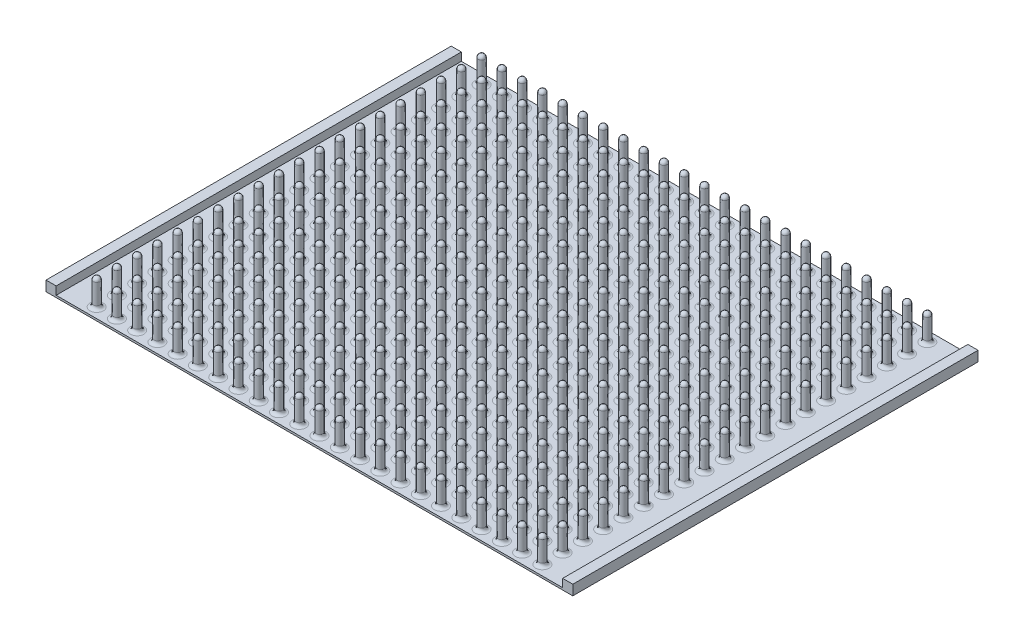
SolidWorks part; units mm, degrees
ref_plane "Front Plane" through (0, 0, 0) normal (0, 0, 1) x (1, 0, 0)
ref_plane "Top Plane" through (0, 0, 0) normal (0, 1, 0) x (1, 0, 0)
ref_plane "Right Plane" through (0, 0, 0) normal (1, 0, 0) x (0, 0, -1)
sketch "Sketch1" plane through (0, 0, 0) normal (0, 1, 0) x (1, 0, 0)
  line L1 (-75, 60) -> (75, 60)
  line L2 (-75, 60) -> (-75, -60)
  line L3 (-75, -60) -> (75, -60)
  line L4 (75, 60) -> (75, -60)
  line L5 (-75, 60) -> (75, -60) construction
  line L6 (-75, -60) -> (75, 60) construction
  point P0 (0, 0)
  dimension "D1" = 150
  dimension "D2" = 120
extrude "Boss-Extrude1" add sketch "Sketch1" along normal blind 0.2
sketch "Sketch2" plane through (0, 0.2, 0) normal (0, 1, 0) x (1, 0, 0)
  line L2 (-75, 60) -> (-75, -60) construction
  line L4 (75, 60) -> (-75, 60) construction
  circle A595 centre (-72, 57) radius 1
  circle A596 centre (-66, 57) radius 1
  circle A597 centre (-60, 57) radius 1
  circle A598 centre (-54, 57) radius 1
  circle A599 centre (-48, 57) radius 1
  circle A600 centre (-42, 57) radius 1
  circle A601 centre (-36, 57) radius 1
  circle A602 centre (-30, 57) radius 1
  circle A603 centre (-24, 57) radius 1
  circle A604 centre (-18, 57) radius 1
  circle A605 centre (-12, 57) radius 1
  circle A606 centre (-6, 57) radius 1
  circle A607 centre (0, 57) radius 1
  circle A608 centre (6, 57) radius 1
  circle A609 centre (12, 57) radius 1
  circle A610 centre (18, 57) radius 1
  circle A611 centre (24, 57) radius 1
  circle A612 centre (30, 57) radius 1
  circle A613 centre (36, 57) radius 1
  circle A614 centre (42, 57) radius 1
  circle A615 centre (48, 57) radius 1
  circle A616 centre (54, 57) radius 1
  circle A617 centre (60, 57) radius 1
  circle A618 centre (66, 57) radius 1
  circle A619 centre (72, 57) radius 1
  circle A620 centre (-66, 51) radius 1
  circle A621 centre (-60, 51) radius 1
  circle A622 centre (-54, 51) radius 1
  circle A623 centre (-48, 51) radius 1
  circle A624 centre (-42, 51) radius 1
  circle A625 centre (-36, 51) radius 1
  circle A626 centre (-30, 51) radius 1
  circle A627 centre (-24, 51) radius 1
  circle A628 centre (-18, 51) radius 1
  circle A629 centre (-12, 51) radius 1
  circle A630 centre (-6, 51) radius 1
  circle A631 centre (0, 51) radius 1
  circle A632 centre (6, 51) radius 1
  circle A633 centre (12, 51) radius 1
  circle A634 centre (18, 51) radius 1
  circle A635 centre (24, 51) radius 1
  circle A636 centre (30, 51) radius 1
  circle A637 centre (36, 51) radius 1
  circle A638 centre (42, 51) radius 1
  circle A639 centre (48, 51) radius 1
  circle A640 centre (54, 51) radius 1
  circle A641 centre (60, 51) radius 1
  circle A642 centre (66, 51) radius 1
  circle A643 centre (72, 51) radius 1
  circle A644 centre (-66, 45) radius 1
  circle A645 centre (-60, 45) radius 1
  circle A646 centre (-54, 45) radius 1
  circle A647 centre (-48, 45) radius 1
  circle A648 centre (-42, 45) radius 1
  circle A649 centre (-36, 45) radius 1
  circle A650 centre (-30, 45) radius 1
  circle A651 centre (-24, 45) radius 1
  circle A652 centre (-18, 45) radius 1
  circle A653 centre (-12, 45) radius 1
  circle A654 centre (-6, 45) radius 1
  circle A655 centre (0, 45) radius 1
  circle A656 centre (6, 45) radius 1
  circle A657 centre (12, 45) radius 1
  circle A658 centre (18, 45) radius 1
  circle A659 centre (24, 45) radius 1
  circle A660 centre (30, 45) radius 1
  circle A661 centre (36, 45) radius 1
  circle A662 centre (42, 45) radius 1
  circle A663 centre (48, 45) radius 1
  circle A664 centre (54, 45) radius 1
  circle A665 centre (60, 45) radius 1
  circle A666 centre (66, 45) radius 1
  circle A667 centre (72, 45) radius 1
  circle A668 centre (-66, 39) radius 1
  circle A669 centre (-60, 39) radius 1
  circle A670 centre (-54, 39) radius 1
  circle A671 centre (-48, 39) radius 1
  circle A672 centre (-42, 39) radius 1
  circle A673 centre (-36, 39) radius 1
  circle A674 centre (-30, 39) radius 1
  circle A675 centre (-24, 39) radius 1
  circle A676 centre (-18, 39) radius 1
  circle A677 centre (-12, 39) radius 1
  circle A678 centre (-6, 39) radius 1
  circle A679 centre (0, 39) radius 1
  circle A680 centre (6, 39) radius 1
  circle A681 centre (12, 39) radius 1
  circle A682 centre (18, 39) radius 1
  circle A683 centre (24, 39) radius 1
  circle A684 centre (30, 39) radius 1
  circle A685 centre (36, 39) radius 1
  circle A686 centre (42, 39) radius 1
  circle A687 centre (48, 39) radius 1
  circle A688 centre (54, 39) radius 1
  circle A689 centre (60, 39) radius 1
  circle A690 centre (66, 39) radius 1
  circle A691 centre (72, 39) radius 1
  circle A692 centre (-66, 33) radius 1
  circle A693 centre (-60, 33) radius 1
  circle A694 centre (-54, 33) radius 1
  circle A695 centre (-48, 33) radius 1
  circle A696 centre (-42, 33) radius 1
  circle A697 centre (-36, 33) radius 1
  circle A698 centre (-30, 33) radius 1
  circle A699 centre (-24, 33) radius 1
  circle A700 centre (-18, 33) radius 1
  circle A701 centre (-12, 33) radius 1
  circle A702 centre (-6, 33) radius 1
  circle A703 centre (0, 33) radius 1
  circle A704 centre (6, 33) radius 1
  circle A705 centre (12, 33) radius 1
  circle A706 centre (18, 33) radius 1
  circle A707 centre (24, 33) radius 1
  circle A708 centre (30, 33) radius 1
  circle A709 centre (36, 33) radius 1
  circle A710 centre (42, 33) radius 1
  circle A711 centre (48, 33) radius 1
  circle A712 centre (54, 33) radius 1
  circle A713 centre (60, 33) radius 1
  circle A714 centre (66, 33) radius 1
  circle A715 centre (72, 33) radius 1
  circle A716 centre (-66, 27) radius 1
  circle A717 centre (-60, 27) radius 1
  circle A718 centre (-54, 27) radius 1
  circle A719 centre (-48, 27) radius 1
  circle A720 centre (-42, 27) radius 1
  circle A721 centre (-36, 27) radius 1
  circle A722 centre (-30, 27) radius 1
  circle A723 centre (-24, 27) radius 1
  circle A724 centre (-18, 27) radius 1
  circle A725 centre (-12, 27) radius 1
  circle A726 centre (-6, 27) radius 1
  circle A727 centre (0, 27) radius 1
  circle A728 centre (6, 27) radius 1
  circle A729 centre (12, 27) radius 1
  circle A730 centre (18, 27) radius 1
  circle A731 centre (24, 27) radius 1
  circle A732 centre (30, 27) radius 1
  circle A733 centre (36, 27) radius 1
  circle A734 centre (42, 27) radius 1
  circle A735 centre (48, 27) radius 1
  circle A736 centre (54, 27) radius 1
  circle A737 centre (60, 27) radius 1
  circle A738 centre (66, 27) radius 1
  circle A739 centre (72, 27) radius 1
  circle A740 centre (-66, 21) radius 1
  circle A741 centre (-60, 21) radius 1
  circle A742 centre (-54, 21) radius 1
  circle A743 centre (-48, 21) radius 1
  circle A744 centre (-42, 21) radius 1
  circle A745 centre (-36, 21) radius 1
  circle A746 centre (-30, 21) radius 1
  circle A747 centre (-24, 21) radius 1
  circle A748 centre (-18, 21) radius 1
  circle A749 centre (-12, 21) radius 1
  circle A750 centre (-6, 21) radius 1
  circle A751 centre (0, 21) radius 1
  circle A752 centre (6, 21) radius 1
  circle A753 centre (12, 21) radius 1
  circle A754 centre (18, 21) radius 1
  circle A755 centre (24, 21) radius 1
  circle A756 centre (30, 21) radius 1
  circle A757 centre (36, 21) radius 1
  circle A758 centre (42, 21) radius 1
  circle A759 centre (48, 21) radius 1
  circle A760 centre (54, 21) radius 1
  circle A761 centre (60, 21) radius 1
  circle A762 centre (66, 21) radius 1
  circle A763 centre (72, 21) radius 1
  circle A764 centre (-66, 15) radius 1
  circle A765 centre (-60, 15) radius 1
  circle A766 centre (-54, 15) radius 1
  circle A767 centre (-48, 15) radius 1
  circle A768 centre (-42, 15) radius 1
  circle A769 centre (-36, 15) radius 1
  circle A770 centre (-30, 15) radius 1
  circle A771 centre (-24, 15) radius 1
  circle A772 centre (-18, 15) radius 1
  circle A773 centre (-12, 15) radius 1
  circle A774 centre (-6, 15) radius 1
  circle A775 centre (0, 15) radius 1
  circle A776 centre (6, 15) radius 1
  circle A777 centre (12, 15) radius 1
  circle A778 centre (18, 15) radius 1
  circle A779 centre (24, 15) radius 1
  circle A780 centre (30, 15) radius 1
  circle A781 centre (36, 15) radius 1
  circle A782 centre (42, 15) radius 1
  circle A783 centre (48, 15) radius 1
  circle A784 centre (54, 15) radius 1
  circle A785 centre (60, 15) radius 1
  circle A786 centre (66, 15) radius 1
  circle A787 centre (72, 15) radius 1
  circle A788 centre (-66, 9) radius 1
  circle A789 centre (-60, 9) radius 1
  circle A790 centre (-54, 9) radius 1
  circle A791 centre (-48, 9) radius 1
  circle A792 centre (-42, 9) radius 1
  circle A793 centre (-36, 9) radius 1
  circle A794 centre (-30, 9) radius 1
  circle A795 centre (-24, 9) radius 1
  circle A796 centre (-18, 9) radius 1
  circle A797 centre (-12, 9) radius 1
  circle A798 centre (-6, 9) radius 1
  circle A799 centre (0, 9) radius 1
  circle A800 centre (6, 9) radius 1
  circle A801 centre (12, 9) radius 1
  circle A802 centre (18, 9) radius 1
  circle A803 centre (24, 9) radius 1
  circle A804 centre (30, 9) radius 1
  circle A805 centre (36, 9) radius 1
  circle A806 centre (42, 9) radius 1
  circle A807 centre (48, 9) radius 1
  circle A808 centre (54, 9) radius 1
  circle A809 centre (60, 9) radius 1
  circle A810 centre (66, 9) radius 1
  circle A811 centre (72, 9) radius 1
  circle A812 centre (-66, 3) radius 1
  circle A813 centre (-60, 3) radius 1
  circle A814 centre (-54, 3) radius 1
  circle A815 centre (-48, 3) radius 1
  circle A816 centre (-42, 3) radius 1
  circle A817 centre (-36, 3) radius 1
  circle A818 centre (-30, 3) radius 1
  circle A819 centre (-24, 3) radius 1
  circle A820 centre (-18, 3) radius 1
  circle A821 centre (-12, 3) radius 1
  circle A822 centre (-6, 3) radius 1
  circle A823 centre (0, 3) radius 1
  circle A824 centre (6, 3) radius 1
  circle A825 centre (12, 3) radius 1
  circle A826 centre (18, 3) radius 1
  circle A827 centre (24, 3) radius 1
  circle A828 centre (30, 3) radius 1
  circle A829 centre (36, 3) radius 1
  circle A830 centre (42, 3) radius 1
  circle A831 centre (48, 3) radius 1
  circle A832 centre (54, 3) radius 1
  circle A833 centre (60, 3) radius 1
  circle A834 centre (66, 3) radius 1
  circle A835 centre (72, 3) radius 1
  circle A836 centre (-66, -3) radius 1
  circle A837 centre (-60, -3) radius 1
  circle A838 centre (-54, -3) radius 1
  circle A839 centre (-48, -3) radius 1
  circle A840 centre (-42, -3) radius 1
  circle A841 centre (-36, -3) radius 1
  circle A842 centre (-30, -3) radius 1
  circle A843 centre (-24, -3) radius 1
  circle A844 centre (-18, -3) radius 1
  circle A845 centre (-12, -3) radius 1
  circle A846 centre (-6, -3) radius 1
  circle A847 centre (0, -3) radius 1
  circle A848 centre (6, -3) radius 1
  circle A849 centre (12, -3) radius 1
  circle A850 centre (18, -3) radius 1
  circle A851 centre (24, -3) radius 1
  circle A852 centre (30, -3) radius 1
  circle A853 centre (36, -3) radius 1
  circle A854 centre (42, -3) radius 1
  circle A855 centre (48, -3) radius 1
  circle A856 centre (54, -3) radius 1
  circle A857 centre (60, -3) radius 1
  circle A858 centre (66, -3) radius 1
  circle A859 centre (72, -3) radius 1
  circle A860 centre (-66, -9) radius 1
  circle A861 centre (-60, -9) radius 1
  circle A862 centre (-54, -9) radius 1
  circle A863 centre (-48, -9) radius 1
  circle A864 centre (-42, -9) radius 1
  circle A865 centre (-36, -9) radius 1
  circle A866 centre (-30, -9) radius 1
  circle A867 centre (-24, -9) radius 1
  circle A868 centre (-18, -9) radius 1
  circle A869 centre (-12, -9) radius 1
  circle A870 centre (-6, -9) radius 1
  circle A871 centre (0, -9) radius 1
  circle A872 centre (6, -9) radius 1
  circle A873 centre (12, -9) radius 1
  circle A874 centre (18, -9) radius 1
  circle A875 centre (24, -9) radius 1
  circle A876 centre (30, -9) radius 1
  circle A877 centre (36, -9) radius 1
  circle A878 centre (42, -9) radius 1
  circle A879 centre (48, -9) radius 1
  circle A880 centre (54, -9) radius 1
  circle A881 centre (60, -9) radius 1
  circle A882 centre (66, -9) radius 1
  circle A883 centre (72, -9) radius 1
  circle A884 centre (-66, -15) radius 1
  circle A885 centre (-60, -15) radius 1
  circle A886 centre (-54, -15) radius 1
  circle A887 centre (-48, -15) radius 1
  circle A888 centre (-42, -15) radius 1
  circle A889 centre (-36, -15) radius 1
  circle A890 centre (-30, -15) radius 1
  circle A891 centre (-24, -15) radius 1
  circle A892 centre (-18, -15) radius 1
  circle A893 centre (-12, -15) radius 1
  circle A894 centre (-6, -15) radius 1
  circle A895 centre (0, -15) radius 1
  circle A896 centre (6, -15) radius 1
  circle A897 centre (12, -15) radius 1
  circle A898 centre (18, -15) radius 1
  circle A899 centre (24, -15) radius 1
  circle A900 centre (30, -15) radius 1
  circle A901 centre (36, -15) radius 1
  circle A902 centre (42, -15) radius 1
  circle A903 centre (48, -15) radius 1
  circle A904 centre (54, -15) radius 1
  circle A905 centre (60, -15) radius 1
  circle A906 centre (66, -15) radius 1
  circle A907 centre (72, -15) radius 1
  circle A908 centre (-66, -21) radius 1
  circle A909 centre (-60, -21) radius 1
  circle A910 centre (-54, -21) radius 1
  circle A911 centre (-48, -21) radius 1
  circle A912 centre (-42, -21) radius 1
  circle A913 centre (-36, -21) radius 1
  circle A914 centre (-30, -21) radius 1
  circle A915 centre (-24, -21) radius 1
  circle A916 centre (-18, -21) radius 1
  circle A917 centre (-12, -21) radius 1
  circle A918 centre (-6, -21) radius 1
  circle A919 centre (0, -21) radius 1
  circle A920 centre (6, -21) radius 1
  circle A921 centre (12, -21) radius 1
  circle A922 centre (18, -21) radius 1
  circle A923 centre (24, -21) radius 1
  circle A924 centre (30, -21) radius 1
  circle A925 centre (36, -21) radius 1
  circle A926 centre (42, -21) radius 1
  circle A927 centre (48, -21) radius 1
  circle A928 centre (54, -21) radius 1
  circle A929 centre (60, -21) radius 1
  circle A930 centre (66, -21) radius 1
  circle A931 centre (72, -21) radius 1
  circle A932 centre (-66, -27) radius 1
  circle A933 centre (-60, -27) radius 1
  circle A934 centre (-54, -27) radius 1
  circle A935 centre (-48, -27) radius 1
  circle A936 centre (-42, -27) radius 1
  circle A937 centre (-36, -27) radius 1
  circle A938 centre (-30, -27) radius 1
  circle A939 centre (-24, -27) radius 1
  circle A940 centre (-18, -27) radius 1
  circle A941 centre (-12, -27) radius 1
  circle A942 centre (-6, -27) radius 1
  circle A943 centre (0, -27) radius 1
  circle A944 centre (6, -27) radius 1
  circle A945 centre (12, -27) radius 1
  circle A946 centre (18, -27) radius 1
  circle A947 centre (24, -27) radius 1
  circle A948 centre (30, -27) radius 1
  circle A949 centre (36, -27) radius 1
  circle A950 centre (42, -27) radius 1
  circle A951 centre (48, -27) radius 1
  circle A952 centre (54, -27) radius 1
  circle A953 centre (60, -27) radius 1
  circle A954 centre (66, -27) radius 1
  circle A955 centre (72, -27) radius 1
  circle A956 centre (-66, -33) radius 1
  circle A957 centre (-60, -33) radius 1
  circle A958 centre (-54, -33) radius 1
  circle A959 centre (-48, -33) radius 1
  circle A960 centre (-42, -33) radius 1
  circle A961 centre (-36, -33) radius 1
  circle A962 centre (-30, -33) radius 1
  circle A963 centre (-24, -33) radius 1
  circle A964 centre (-18, -33) radius 1
  circle A965 centre (-12, -33) radius 1
  circle A966 centre (-6, -33) radius 1
  circle A967 centre (0, -33) radius 1
  circle A968 centre (6, -33) radius 1
  circle A969 centre (12, -33) radius 1
  circle A970 centre (18, -33) radius 1
  circle A971 centre (24, -33) radius 1
  circle A972 centre (30, -33) radius 1
  circle A973 centre (36, -33) radius 1
  circle A974 centre (42, -33) radius 1
  circle A975 centre (48, -33) radius 1
  circle A976 centre (54, -33) radius 1
  circle A977 centre (60, -33) radius 1
  circle A978 centre (66, -33) radius 1
  circle A979 centre (72, -33) radius 1
  circle A980 centre (-66, -39) radius 1
  circle A981 centre (-60, -39) radius 1
  circle A982 centre (-54, -39) radius 1
  circle A983 centre (-48, -39) radius 1
  circle A984 centre (-42, -39) radius 1
  circle A985 centre (-36, -39) radius 1
  circle A986 centre (-30, -39) radius 1
  circle A987 centre (-24, -39) radius 1
  circle A988 centre (-18, -39) radius 1
  circle A989 centre (-12, -39) radius 1
  circle A990 centre (-6, -39) radius 1
  circle A991 centre (0, -39) radius 1
  circle A992 centre (6, -39) radius 1
  circle A993 centre (12, -39) radius 1
  circle A994 centre (18, -39) radius 1
  circle A995 centre (24, -39) radius 1
  circle A996 centre (30, -39) radius 1
  circle A997 centre (36, -39) radius 1
  circle A998 centre (42, -39) radius 1
  circle A999 centre (48, -39) radius 1
  circle A1000 centre (54, -39) radius 1
  circle A1001 centre (60, -39) radius 1
  circle A1002 centre (66, -39) radius 1
  circle A1003 centre (72, -39) radius 1
  circle A1004 centre (-66, -45) radius 1
  circle A1005 centre (-60, -45) radius 1
  circle A1006 centre (-54, -45) radius 1
  circle A1007 centre (-48, -45) radius 1
  circle A1008 centre (-42, -45) radius 1
  circle A1009 centre (-36, -45) radius 1
  circle A1010 centre (-30, -45) radius 1
  circle A1011 centre (-24, -45) radius 1
  circle A1012 centre (-18, -45) radius 1
  circle A1013 centre (-12, -45) radius 1
  circle A1014 centre (-6, -45) radius 1
  circle A1015 centre (0, -45) radius 1
  circle A1016 centre (6, -45) radius 1
  circle A1017 centre (12, -45) radius 1
  circle A1018 centre (18, -45) radius 1
  circle A1019 centre (24, -45) radius 1
  circle A1020 centre (30, -45) radius 1
  circle A1021 centre (36, -45) radius 1
  circle A1022 centre (42, -45) radius 1
  circle A1023 centre (48, -45) radius 1
  circle A1024 centre (54, -45) radius 1
  circle A1025 centre (60, -45) radius 1
  circle A1026 centre (66, -45) radius 1
  circle A1027 centre (72, -45) radius 1
  circle A1028 centre (-66, -51) radius 1
  circle A1029 centre (-60, -51) radius 1
  circle A1030 centre (-54, -51) radius 1
  circle A1031 centre (-48, -51) radius 1
  circle A1032 centre (-42, -51) radius 1
  circle A1033 centre (-36, -51) radius 1
  circle A1034 centre (-30, -51) radius 1
  circle A1035 centre (-24, -51) radius 1
  circle A1036 centre (-18, -51) radius 1
  circle A1037 centre (-12, -51) radius 1
  circle A1038 centre (-6, -51) radius 1
  circle A1039 centre (0, -51) radius 1
  circle A1040 centre (6, -51) radius 1
  circle A1041 centre (12, -51) radius 1
  circle A1042 centre (18, -51) radius 1
  circle A1043 centre (24, -51) radius 1
  circle A1044 centre (30, -51) radius 1
  circle A1045 centre (36, -51) radius 1
  circle A1046 centre (42, -51) radius 1
  circle A1047 centre (48, -51) radius 1
  circle A1048 centre (54, -51) radius 1
  circle A1049 centre (60, -51) radius 1
  circle A1050 centre (66, -51) radius 1
  circle A1051 centre (72, -51) radius 1
  circle A1052 centre (-66, -57) radius 1
  circle A1053 centre (-60, -57) radius 1
  circle A1054 centre (-54, -57) radius 1
  circle A1055 centre (-48, -57) radius 1
  circle A1056 centre (-42, -57) radius 1
  circle A1057 centre (-36, -57) radius 1
  circle A1058 centre (-30, -57) radius 1
  circle A1059 centre (-24, -57) radius 1
  circle A1060 centre (-18, -57) radius 1
  circle A1061 centre (-12, -57) radius 1
  circle A1062 centre (-6, -57) radius 1
  circle A1063 centre (0, -57) radius 1
  circle A1064 centre (6, -57) radius 1
  circle A1065 centre (12, -57) radius 1
  circle A1066 centre (18, -57) radius 1
  circle A1067 centre (24, -57) radius 1
  circle A1068 centre (30, -57) radius 1
  circle A1069 centre (36, -57) radius 1
  circle A1070 centre (42, -57) radius 1
  circle A1071 centre (48, -57) radius 1
  circle A1072 centre (54, -57) radius 1
  circle A1073 centre (60, -57) radius 1
  circle A1074 centre (66, -57) radius 1
  circle A1075 centre (72, -57) radius 1
  circle A1076 centre (-72, 51) radius 1
  circle A1077 centre (-72, 45) radius 1
  circle A1078 centre (-72, 39) radius 1
  circle A1079 centre (-72, 33) radius 1
  circle A1080 centre (-72, 27) radius 1
  circle A1081 centre (-72, 21) radius 1
  circle A1082 centre (-72, 15) radius 1
  circle A1083 centre (-72, 9) radius 1
  circle A1084 centre (-72, 3) radius 1
  circle A1085 centre (-72, -3) radius 1
  circle A1086 centre (-72, -9) radius 1
  circle A1087 centre (-72, -15) radius 1
  circle A1088 centre (-72, -21) radius 1
  circle A1089 centre (-72, -27) radius 1
  circle A1090 centre (-72, -33) radius 1
  circle A1091 centre (-72, -39) radius 1
  circle A1092 centre (-72, -45) radius 1
  circle A1093 centre (-72, -51) radius 1
  circle A1094 centre (-72, -57) radius 1
  dimension "D1" = 2
  dimension "D2" = 3
  dimension "D3" = 3
extrude "Boss-Extrude2" add sketch "Sketch2" along normal blind 8
fillet "Fillet2" radius 1 2 edges at (-72, 8.2, -56) (-72, 0.2, -56)
fillet "Fillet3" radius 1 400 edges at (-72, 0.2, 52) (-72, 8.2, 52) (-72, 0.2, 58) (-72, 8.2, 58) (-72, 0.2, 46) (-72, 8.2, 46) (-72, 0.2, 40) (-72, 8.2, 40) (-72, 0.2, 34) (-72, 8.2, 34) (-72, 0.2, 28) (-72, 8.2, 28) (-72, 0.2, 22) (-72, 8.2, 22) (-72, 0.2, 16) (-72, 8.2, 16) (-72, 0.2, 10) (-72, 8.2, 10) (-72, 0.2, 4) (-72, 8.2, 4) (-72, 0.2, -2) (-72, 8.2, -2) (-72, 0.2, -8) (-72, 8.2, -8) (-72, 0.2, -14) (-72, 8.2, -14) (-72, 0.2, -20) (-72, 8.2, -20) (-72, 0.2, -26) (-72, 8.2, -26) (-72, 0.2, -32) (-72, 8.2, -32) (-72, 0.2, -38) (-72, 8.2, -38) (-72, 0.2, -44) (-72, 8.2, -44) (-72, 0.2, -50) (-72, 8.2, -50) (72, 0.2, 58) (72, 8.2, 58) (66, 0.2, 58) (66, 8.2, 58) (60, 0.2, 58) (60, 8.2, 58) (54, 0.2, 58) (54, 8.2, 58) (48, 0.2, 58) (48, 8.2, 58) (42, 0.2, 58) (42, 8.2, 58) (36, 0.2, 58) (36, 8.2, 58) (30, 0.2, 58) (30, 8.2, 58) (24, 0.2, 58) (24, 8.2, 58) (18, 0.2, 58) (18, 8.2, 58) (12, 0.2, 58) (12, 8.2, 58) (6, 0.2, 58) (6, 8.2, 58) (0, 0.2, 58) (0, 8.2, 58) (-6, 0.2, 58) (-6, 8.2, 58) (-12, 0.2, 58) (-12, 8.2, 58) (-18, 0.2, 58) (-18, 8.2, 58) (-24, 0.2, 58) (-24, 8.2, 58) (-30, 0.2, 58) (-30, 8.2, 58) (-36, 0.2, 58) (-36, 8.2, 58) (-42, 0.2, 58) (-42, 8.2, 58) (-48, 0.2, 58) (-48, 8.2, 58) (-54, 0.2, 58) (-54, 8.2, 58) (-60, 0.2, 58) (-60, 8.2, 58) (-66, 0.2, 58) (-66, 8.2, 58) (72, 0.2, 52) (72, 8.2, 52) (66, 0.2, 52) (66, 8.2, 52) (60, 0.2, 52) (60, 8.2, 52) (54, 0.2, 52) (54, 8.2, 52) (48, 0.2, 52) (48, 8.2, 52) (42, 0.2, 52) (42, 8.2, 52) (36, 0.2, 52) (36, 8.2, 52) (30, 0.2, 52) (30, 8.2, 52) (24, 0.2, 52) (24, 8.2, 52) (18, 0.2, 52) (18, 8.2, 52) (12, 0.2, 52) (12, 8.2, 52) (6, 0.2, 52) (6, 8.2, 52) (0, 0.2, 52) (0, 8.2, 52) (-6, 0.2, 52) (-6, 8.2, 52) (-12, 0.2, 52) (-12, 8.2, 52) (-18, 0.2, 52) (-18, 8.2, 52) (-24, 0.2, 52) (-24, 8.2, 52) (-30, 0.2, 52) (-30, 8.2, 52) (-36, 0.2, 52) (-36, 8.2, 52) (-42, 0.2, 52) (-42, 8.2, 52) (-48, 0.2, 52) (-48, 8.2, 52) (-54, 0.2, 52) (-54, 8.2, 52) (-60, 0.2, 52) (-60, 8.2, 52) (-66, 0.2, 52) (-66, 8.2, 52) (72, 0.2, 46) (72, 8.2, 46) (66, 0.2, 46) (66, 8.2, 46) (60, 0.2, 46) (60, 8.2, 46) (54, 0.2, 46) (54, 8.2, 46) (48, 0.2, 46) (48, 8.2, 46) (42, 0.2, 46) (42, 8.2, 46) (36, 0.2, 46) (36, 8.2, 46) (30, 0.2, 46) (30, 8.2, 46) (24, 0.2, 46) (24, 8.2, 46) (18, 0.2, 46) (18, 8.2, 46) (12, 0.2, 46) (12, 8.2, 46) (6, 0.2, 46) (6, 8.2, 46) (0, 0.2, 46) (0, 8.2, 46) (-6, 0.2, 46) (-6, 8.2, 46) (-12, 0.2, 46) (-12, 8.2, 46) (-18, 0.2, 46) (-18, 8.2, 46) (-24, 0.2, 46) (-24, 8.2, 46) (-30, 0.2, 46) (-30, 8.2, 46) (-36, 0.2, 46) (-36, 8.2, 46) (-42, 0.2, 46) (-42, 8.2, 46) (-48, 0.2, 46) (-48, 8.2, 46) (-54, 0.2, 46) (-54, 8.2, 46) (-60, 0.2, 46) (-60, 8.2, 46) (-66, 0.2, 46) (-66, 8.2, 46) (72, 0.2, 40) (72, 8.2, 40) (66, 0.2, 40) (66, 8.2, 40) (60, 0.2, 40) (60, 8.2, 40) (54, 0.2, 40) (54, 8.2, 40) (48, 0.2, 40) (48, 8.2, 40) (42, 0.2, 40) (42, 8.2, 40) (36, 0.2, 40) (36, 8.2, 40) (30, 0.2, 40) (30, 8.2, 40) (24, 0.2, 40) (24, 8.2, 40) (18, 0.2, 40) (18, 8.2, 40) (12, 0.2, 40) (12, 8.2, 40) (6, 0.2, 40) (6, 8.2, 40) (0, 0.2, 40) (0, 8.2, 40) (-6, 0.2, 40) (-6, 8.2, 40) (-12, 0.2, 40) (-12, 8.2, 40) (-18, 0.2, 40) (-18, 8.2, 40) (-24, 0.2, 40) (-24, 8.2, 40) (-30, 0.2, 40) (-30, 8.2, 40) (-36, 0.2, 40) (-36, 8.2, 40) (-42, 0.2, 40) (-42, 8.2, 40) (-48, 0.2, 40) (-48, 8.2, 40) (-54, 0.2, 40) (-54, 8.2, 40) (-60, 0.2, 40) (-60, 8.2, 40) (-66, 0.2, 40) (-66, 8.2, 40) (72, 0.2, 34) (72, 8.2, 34) (66, 0.2, 34) (66, 8.2, 34) (60, 0.2, 34) (60, 8.2, 34) (54, 0.2, 34) (54, 8.2, 34) (48, 0.2, 34) (48, 8.2, 34) (42, 0.2, 34) (42, 8.2, 34) (36, 0.2, 34) (36, 8.2, 34) (30, 0.2, 34) (30, 8.2, 34) (24, 0.2, 34) (24, 8.2, 34) (18, 0.2, 34) (18, 8.2, 34) (12, 0.2, 34) (12, 8.2, 34) (6, 0.2, 34) (6, 8.2, 34) (0, 0.2, 34) (0, 8.2, 34) (-6, 0.2, 34) (-6, 8.2, 34) (-12, 0.2, 34) (-12, 8.2, 34) (-18, 0.2, 34) (-18, 8.2, 34) (-24, 0.2, 34) (-24, 8.2, 34) (-30, 0.2, 34) (-30, 8.2, 34) (-36, 0.2, 34) (-36, 8.2, 34) (-42, 0.2, 34) (-42, 8.2, 34) (-48, 0.2, 34) (-48, 8.2, 34) (-54, 0.2, 34) (-54, 8.2, 34) (-60, 0.2, 34) (-60, 8.2, 34) (-66, 0.2, 34) (-66, 8.2, 34) (72, 0.2, 28) (72, 8.2, 28) (66, 0.2, 28) (66, 8.2, 28) (60, 0.2, 28) (60, 8.2, 28) (54, 0.2, 28) (54, 8.2, 28) (48, 0.2, 28) (48, 8.2, 28) (42, 0.2, 28) (42, 8.2, 28) (36, 0.2, 28) (36, 8.2, 28) (30, 0.2, 28) (30, 8.2, 28) (24, 0.2, 28) (24, 8.2, 28) (18, 0.2, 28) (18, 8.2, 28) (12, 0.2, 28) (12, 8.2, 28) (6, 0.2, 28) (6, 8.2, 28) (0, 0.2, 28) (0, 8.2, 28) (-6, 0.2, 28) (-6, 8.2, 28) (-12, 0.2, 28) (-12, 8.2, 28) (-18, 0.2, 28) (-18, 8.2, 28) (-24, 0.2, 28) (-24, 8.2, 28) (-30, 0.2, 28) (-30, 8.2, 28) (-36, 0.2, 28) (-36, 8.2, 28) (-42, 0.2, 28) (-42, 8.2, 28) (-48, 0.2, 28) (-48, 8.2, 28) (-54, 0.2, 28) (-54, 8.2, 28) (-60, 0.2, 28) (-60, 8.2, 28) (-66, 0.2, 28) (-66, 8.2, 28) (72, 0.2, 22) (72, 8.2, 22) (66, 0.2, 22) (66, 8.2, 22) (60, 0.2, 22) (60, 8.2, 22) (54, 0.2, 22) (54, 8.2, 22) (48, 0.2, 22) (48, 8.2, 22) (42, 0.2, 22) (42, 8.2, 22) (36, 0.2, 22) (36, 8.2, 22) (30, 0.2, 22) (30, 8.2, 22) (24, 0.2, 22) (24, 8.2, 22) (18, 0.2, 22) (18, 8.2, 22) (12, 0.2, 22) (12, 8.2, 22) (6, 0.2, 22) (6, 8.2, 22) (0, 0.2, 22) (0, 8.2, 22) (-6, 0.2, 22) (-6, 8.2, 22) (-12, 0.2, 22) (-12, 8.2, 22) (-18, 0.2, 22) (-18, 8.2, 22) (-24, 0.2, 22) (-24, 8.2, 22) (-30, 0.2, 22) (-30, 8.2, 22) (-36, 0.2, 22) (-36, 8.2, 22) (-42, 0.2, 22) (-42, 8.2, 22) (-48, 0.2, 22) (-48, 8.2, 22) (-54, 0.2, 22) (-54, 8.2, 22) (-60, 0.2, 22) (-60, 8.2, 22) (-66, 0.2, 22) (-66, 8.2, 22) (72, 0.2, 16) (72, 8.2, 16) (66, 0.2, 16) (66, 8.2, 16) (60, 0.2, 16) (60, 8.2, 16) (54, 0.2, 16) (54, 8.2, 16) (48, 0.2, 16) (48, 8.2, 16) (42, 0.2, 16) (42, 8.2, 16) (36, 0.2, 16) (36, 8.2, 16) (30, 0.2, 16) (30, 8.2, 16) (24, 0.2, 16) (24, 8.2, 16) (18, 0.2, 16) (18, 8.2, 16) (12, 0.2, 16) (12, 8.2, 16) (6, 0.2, 16) (6, 8.2, 16) (0, 0.2, 16) (0, 8.2, 16)
sketch "Sketch4" plane through (0, 0, 0) normal (0, -1, 0) x (1, 0, 0)
  line L4 (75, -60) -> (75, 60)
  line L5 (75, 60) -> (-75, 60)
  line L6 (-75, 60) -> (-75, -60)
  line L7 (-75, -60) -> (75, -60)
  line L8 (75, -60) -> (75, 60)
  line L9 (75, 60) -> (-75, 60)
  line L10 (-75, 60) -> (-75, -60)
  line L11 (-75, -60) -> (75, -60)
  dimension "D1" = 0
extrude "Boss-Extrude3" add sketch "Sketch4" along normal blind 0.4 and the other way up to surface
sketch "Sketch6" plane through (75, 0, 0) normal (1, 0, 0) x (0, 0, -1)
  line L4 (60, -0.4) -> (60, 0.2)
  line L5 (60, 0.2) -> (-60, 0.2)
  line L6 (-60, 0.2) -> (-60, -0.4)
  line L7 (-60, -0.4) -> (60, -0.4)
  line L8 (60, -0.4) -> (60, 0.2)
  line L9 (60, 0.2) -> (-60, 0.2)
  line L10 (-60, 0.2) -> (-60, -0.4)
  line L11 (-60, -0.4) -> (60, -0.4)
  dimension "D1" = 0
extrude "Boss-Extrude4" add sketch "Sketch6" along normal blind 3
sketch "Sketch7" plane through (-75, 0, 0) normal (-1, 0, 0) x (0, 0, 1)
  line L4 (60, -0.4) -> (60, 0.2)
  line L5 (60, 0.2) -> (-60, 0.2)
  line L6 (-60, 0.2) -> (-60, -0.4)
  line L7 (-60, -0.4) -> (60, -0.4)
  line L8 (60, -0.4) -> (60, 0.2)
  line L9 (60, 0.2) -> (-60, 0.2)
  line L10 (-60, 0.2) -> (-60, -0.4)
  line L11 (-60, -0.4) -> (60, -0.4)
  dimension "D1" = 0
extrude "Boss-Extrude5" add sketch "Sketch7" along normal blind 3
sketch "Sketch8" plane through (0, 0.2, 0) normal (0, 1, 0) x (1, 0, 0)
  line L0 (-75.5042, 60) -> (-75.5042, -60)
  line L1 (-78, 60) -> (78, 60) construction
  line L2 (78, -60) -> (-78, -60) construction
  line L3 (-75.5042, -60) -> (-69.1643, -60)
  line L4 (-69.1643, -60) -> (-69.1643, 60)
  line L5 (-69.1643, 60) -> (-75.5042, 60)
  line L6 (68.8535, 60) -> (68.8535, -60)
  line L7 (68.8535, -60) -> (75.356, -60)
  line L8 (75.356, -60) -> (75.356, 60)
  line L9 (75.356, 60) -> (68.8535, 60)
extrude "Cut-Extrude2" cut sketch "Sketch8" along normal through all
sketch "Sketch9" plane through (0, -0.4, 0) normal (0, -1, 0) x (1, 0, 0)
  line L0 (-78, -60) -> (78, -60) construction
  line L1 (78, 60) -> (75, 60)
  line L2 (78, 60) -> (78, -60)
  line L3 (78, -60) -> (75, -60)
  line L4 (75, 60) -> (75, -60)
  line L5 (78, 60) -> (-78, 60) construction
  line L6 (-78, -60) -> (-75, -60)
  line L7 (-78, -60) -> (-78, 60)
  line L8 (-78, 60) -> (-75, 60)
  line L9 (-75, -60) -> (-75, 60)
  dimension "D1" = 3
  dimension "D2" = 3
extrude "Boss-Extrude6" add sketch "Sketch9" against normal blind 3
